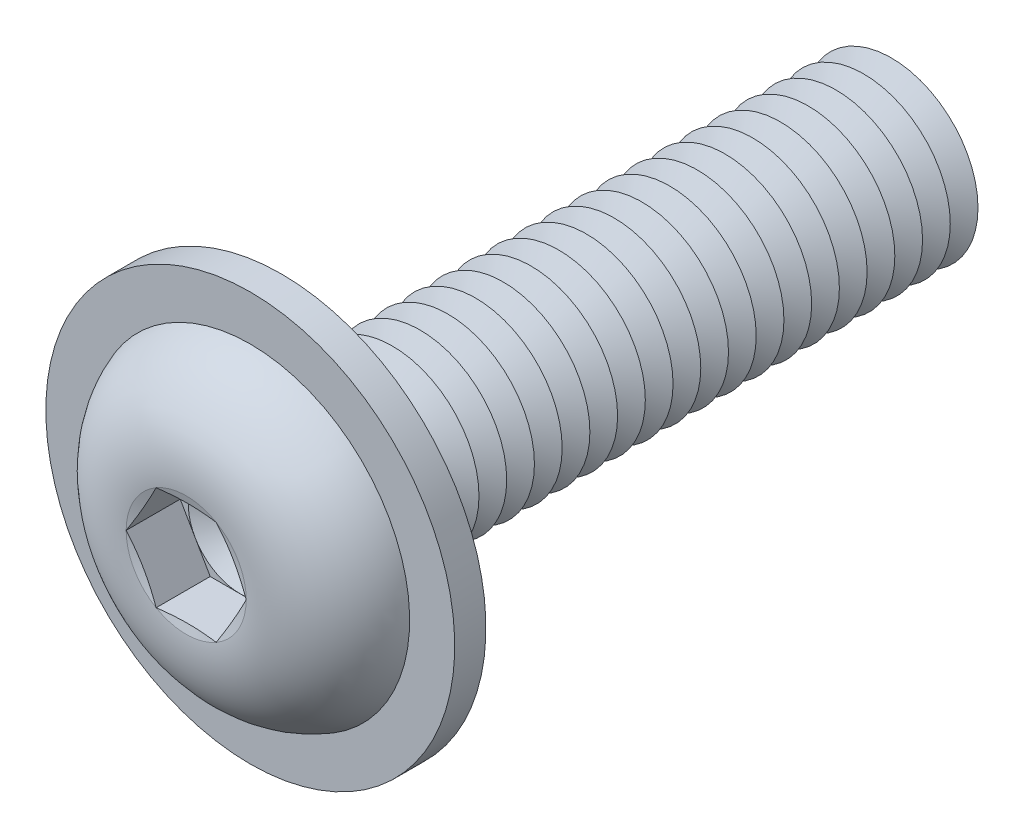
SolidWorks part; units mm, degrees
ref_plane "Front Plane" through (0, 0, 0) normal (0, 0, 1) x (1, 0, 0)
ref_plane "Top Plane" through (0, 0, 0) normal (0, 1, 0) x (1, 0, 0)
ref_plane "Right Plane" through (0, 0, 0) normal (1, 0, 0) x (0, 0, -1)
sketch "Sketch1" plane through (0, 0, 0) normal (1, 0, 0) x (0, 0, -1)
  line L0 (0, 2.5) -> (0, 4.75)
  line L3 (0, 2.5) -> (18, 2.5)
  line L4 (18, 2.5) -> (18, 0)
  line L5 (18, 0) -> (-2.75, 0) construction
  line L6 (-2.75, 0) -> (18, 0)
  line L7 (-2.75, 1.732) -> (-2.75, 0.866) construction
  line L8 (-2.75, 0.866) -> (-2.75, 0)
  line L9 (-2.75, 1.732) -> (-2.5179, 0.866)
  line L10 (-2.5179, 0.866) -> (-2.75, 0.866)
  line L11 (18, 0) -> (22.7481, 0) construction
  line L12 (0, 4.75) -> (-2.75, 4.75) construction
  arc A1 (0, 4.75) -> (-2.75, 1.732) centre (0, 1.9881) ccw
  point P8 (18, 1.25)
  dimension "D1" = 9.5
  dimension "D2" = 5
  dimension "D3" = 2.75
  dimension "D4" = 3.4641
  dimension "D5" = 18
  dimension "D6" = 15
revolve "Revolve1" add sketch "Sketch1" angle 360 about L5
fillet "Fillet1" radius 0.4 1 edges at (-2.5, 0, 0)
sketch "Sketch2" plane through (0, 0, 0) normal (1, 0, 0) x (0, 0, -1)
  line L0 (17.6, 2.5) -> (18.4, 2.5)
  line L1 (18, 2.5) -> (0.4, 2.5) construction
  line L2 (18.4, 2.5) -> (18, 1.8072)
  line L3 (18, -2.5) -> (18, 2.5) construction
  line L4 (18, 1.8072) -> (17.6, 2.5)
  dimension "D1" = 0.8
revolve "Cut-Revolve1" cut sketch "Sketch2" angle 360 about axis through (0, 0, -18) along (0, 0, -1)
pattern_linear "LPattern1" count 22 spacing 0.8 along (0, 0, 1) of "Cut-Revolve1"
sketch "Sketch3" plane through (0, 0, 2.75) normal (0, 0, 1) x (1, 0, 0)
  line L7 (0.866, 1.5) -> (-0.866, 1.5)
  line L8 (-0.866, 1.5) -> (-1.7321, 0)
  line L9 (-1.7321, 0) -> (-0.866, -1.5)
  line L10 (-0.866, -1.5) -> (0.866, -1.5)
  line L11 (0.866, -1.5) -> (1.732, 0)
  line L12 (1.732, 0) -> (0.866, 1.5)
  circle A0 centre (0, 0) radius 1.5 construction
  circle A3 centre (0, 0) radius 1.7321 construction
extrude "Cut-Extrude1" cut sketch "Sketch3" against normal blind 1.56
sketch "Sketch4" plane through (0, 0, 1.19) normal (0, 0, 1) x (1, 0, 0)
  line L1 (0.866, 1.5) -> (-0.866, 1.5) construction
  circle A0 centre (0, 0) radius 1.5
extrude "Cut-Extrude2" cut sketch "Sketch4" against normal through all draft 60
sketch "Sketch5" plane through (0, 0, 0) normal (0, 0, -1) x (-1, 0, 0)
  circle A0 centre (0, 0) radius 5.9
  circle A1 centre (0, 0) radius 2.9
  circle A2 centre (0, 0) radius 2.9 construction
  dimension "D1" = 11.8
extrude "Boss-Extrude1" add sketch "Sketch5" against normal blind 0.9
